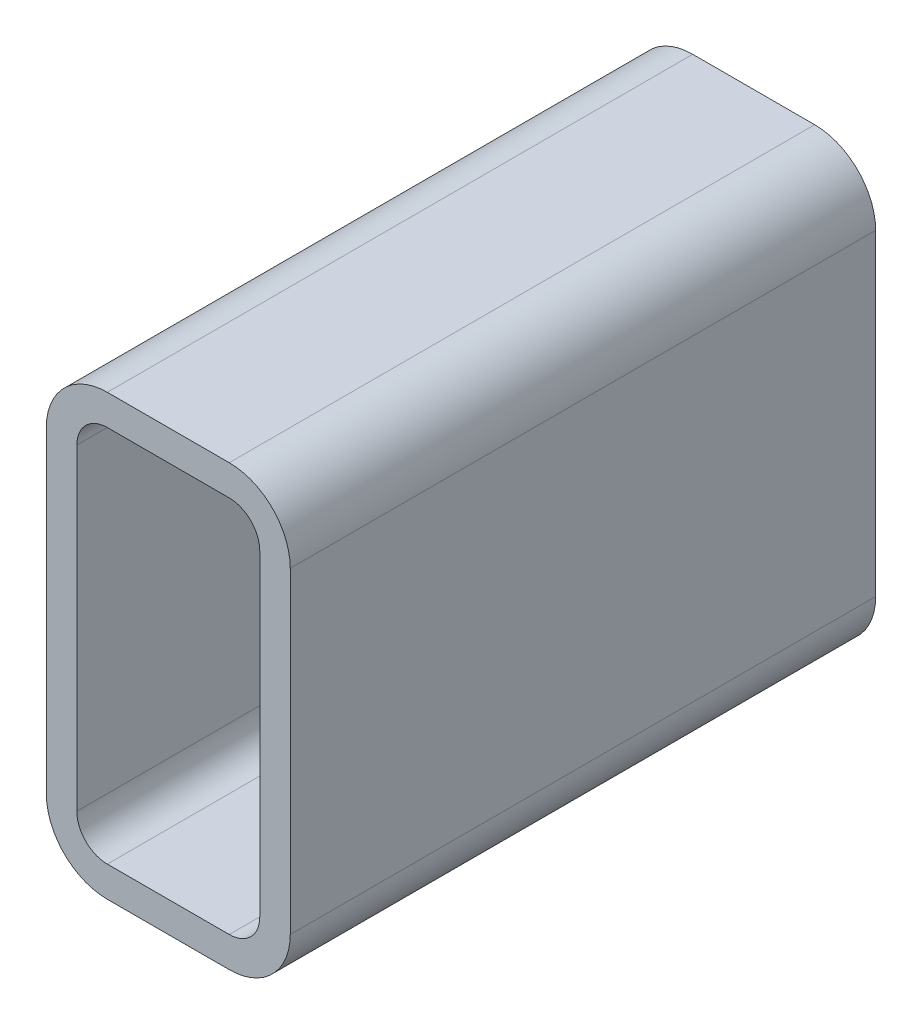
SolidWorks part; units mm, degrees
ref_plane "Front Plane" through (0, 0, 0) normal (0, 0, 1) x (1, 0, 0)
ref_plane "Top Plane" through (0, 0, 0) normal (0, 1, 0) x (1, 0, 0)
ref_plane "Right Plane" through (0, 0, 0) normal (1, 0, 0) x (0, 0, -1)
sketch "Sketch1" plane through (0, 0, 0) normal (0, 0, 1) x (1, 0, 0)
sketch_block_instance "HSS9x5x0.625-1"
sketch_block "HSS9x5x0.625"
extrude "Boss-Extrude1" add sketch "Sketch1" along normal blind 304.8
